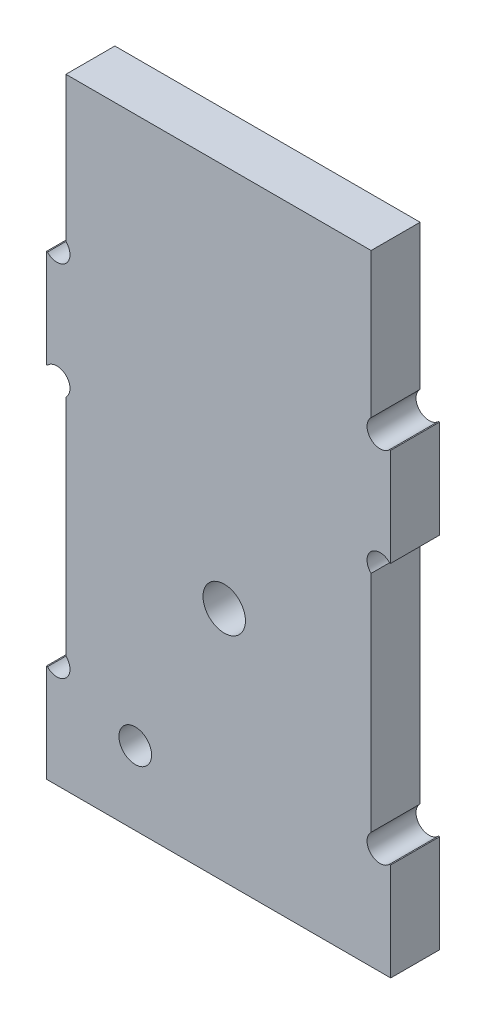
SolidWorks part; units mm, degrees
ref_plane "Plan de face" through (0, 0, 0) normal (0, 0, 1) x (1, 0, 0)
ref_plane "Plan de dessus" through (0, 0, 0) normal (0, 1, 0) x (1, 0, 0)
ref_plane "Plan de droite" through (0, 0, 0) normal (1, 0, 0) x (0, 0, -1)
sketch "Esquisse1" plane through (0, 0, 0) normal (0, 0, 1) x (1, 0, 0)
  line L0 (0, 41.289) -> (0, -35.1803) construction
  line L1 (-15, 27) -> (15, 27) construction
  line L2 (-15, 27) -> (-15, -27) construction
  line L3 (-15, -27) -> (15, -27) construction
  line L4 (15, 27) -> (15, -27) construction
  line L5 (-15, 27) -> (15, -27) construction
  line L6 (-15, -27) -> (15, 27) construction
  line L7 (-34.1389, 0) -> (26.846, 0) construction
  line L8 (-35.4491, -29) -> (54.1224, -29) construction
  line L9 (18.7, 32.9512) -> (18.7, -35.1803) construction
  line L10 (24.7, 34.7726) -> (24.7, -34.2274) construction
  line L11 (-23.2998, 27) -> (36.494, 27) construction
  line L12 (11, 15) -> (36.494, 15) construction
  line L13 (9.4444, -17) -> (55.5518, -17) construction
  line L14 (-24.7, 27) -> (24.7, 27)
  line L15 (24.7, 27) -> (24.7, 15)
  line L16 (24.7, 15) -> (20.9619, 15)
  line L17 (18.7, 12.7381) -> (18.7, -14.7381)
  line L18 (20.9619, -17) -> (24.7, -17)
  line L19 (24.7, -17) -> (24.7, -29)
  line L20 (24.7, -29) -> (-24.7, -29)
  line L21 (-24.7, 27) -> (-24.7, 15)
  line L22 (-24.7, 15) -> (-20.9619, 15)
  line L23 (-18.7, 12.7381) -> (-18.7, -14.7381)
  line L24 (-20.9619, -17) -> (-24.7, -17)
  line L25 (-24.7, -17) -> (-24.7, -29)
  circle A0 centre (-11, 23) radius 1 construction
  circle A1 centre (11, 23) radius 1 construction
  circle A2 centre (-11, -23) radius 1 construction
  circle A3 centre (11, -23) radius 1 construction
  arc A4 (20.9619, 15) -> (18.7, 12.7381) centre (19.8, 13.9) ccw
  arc A5 (18.7, -14.7381) -> (20.9619, -17) centre (19.8, -15.9) ccw
  arc A6 (-20.9619, 15) -> (-18.7, 12.7381) centre (-19.8, 13.9) cw
  arc A7 (-18.7, -14.7381) -> (-20.9619, -17) centre (-19.8, -15.9) cw
  point P0 (0, 0)
  point P50 (0, 27)
  point P53 (0, -29)
  dimension "D3" = 11
  dimension "D10" = 1.1
  dimension "D12" = 1.1
  dimension "D1" = 30
  dimension "D2" = 54
  dimension "D4" = 23
  dimension "D5" = 29
  dimension "D6" = 18.7
  dimension "D7" = 6
  dimension "D8" = 12
  dimension "D9" = 12
  dimension "D11" = 1.1
  dimension "D13" = 1.1
extrude "Boss.-Extru.1" add sketch "Esquisse1" along normal blind 6
sketch "Esquisse2" plane through (0, 0, 6) normal (0, 0, 1) x (1, 0, 0)
  line L0 (18.7, -7.6562) -> (18.7, 50.5499) construction
  line L1 (18.7, -14.7381) -> (18.7, 12.7381) construction
  line L2 (-18.7, -12.188) -> (-18.7, 50.5499) construction
  line L3 (-18.7, 12.7381) -> (-18.7, -14.7381) construction
  line L4 (-42.6986, 47) -> (29.5279, 47) construction
  line L5 (24.7, 27) -> (-24.7, 27) construction
  line L7 (-18.7, 47) -> (18.7, 47)
  line L8 (-18.7, 47) -> (-18.7, 25.6247)
  line L9 (-18.7, 25.6247) -> (18.7, 25.6247)
  line L10 (18.7, 47) -> (18.7, 25.6247)
  dimension "D1" = 20
extrude "Boss.-Extru.2" add sketch "Esquisse2" against normal blind 6
sketch "Esquisse3" plane through (0, 0, 6) normal (0, 0, 1) x (1, 0, 0)
  line L0 (-18.7, 47) -> (-18.7, 27) construction
  line L2 (-18.7, 27) -> (-24.7, 27) construction
  line L3 (0, 47) -> (0, 22.5795) construction
  line L4 (18.7, 47) -> (-18.7, 47) construction
  circle A0 centre (-19.8, 28.1) radius 1.6
  circle A1 centre (19.8, 28.1) radius 1.6
  dimension "D1" = 1.1
  dimension "D2" = 1.1
extrude "Enlèv. mat.-Extru.1" cut sketch "Esquisse3" against normal through all
sketch "Esquisse4" plane through (0, 0, 6) normal (0, 0, 1) x (1, 0, 0)
  line L0 (24.7, 15) -> (24.7, 27) construction
  line L1 (-24.7, -29) -> (24.7, -29) construction
  line L3 (-24.7, -17) -> (-24.7, -29) construction
  circle A0 centre (-10.2, -20) radius 2
  circle A1 centre (0.7, 0) radius 2.6
  dimension "D1" = 24
  dimension "D2" = 29
  dimension "D3" = 14.5
  dimension "D4" = 9
extrude "Enlèv. mat.-Extru.2" cut sketch "Esquisse4" against normal through all
sketch "Esquisse5" plane through (0, 0, 6) normal (0, 0, 1) x (1, 0, 0)
  line L0 (0, 53.0394) -> (0, -36.4559) construction
  line L2 (35.1655, 40.9044) -> (21.1, 40.9044)
  line L3 (35.1655, 40.9044) -> (35.1655, -37.4212)
  line L4 (35.1655, -37.4212) -> (21.1, -37.4212)
  line L5 (21.1, 40.9044) -> (21.1, -37.4212)
  line L6 (-35.1655, -37.4212) -> (-21.1, -37.4212)
  line L7 (-35.1655, 40.9044) -> (-35.1655, -37.4212)
  line L8 (-35.1655, 40.9044) -> (-21.1, 40.9044)
  line L9 (-21.1, 40.9044) -> (-21.1, -37.4212)
  line L10 (18.7, 29.2619) -> (18.7, 47) construction
  dimension "D1" = 2.4
extrude "Enlèv. mat.-Extru.3" cut sketch "Esquisse5" against normal blind 10
